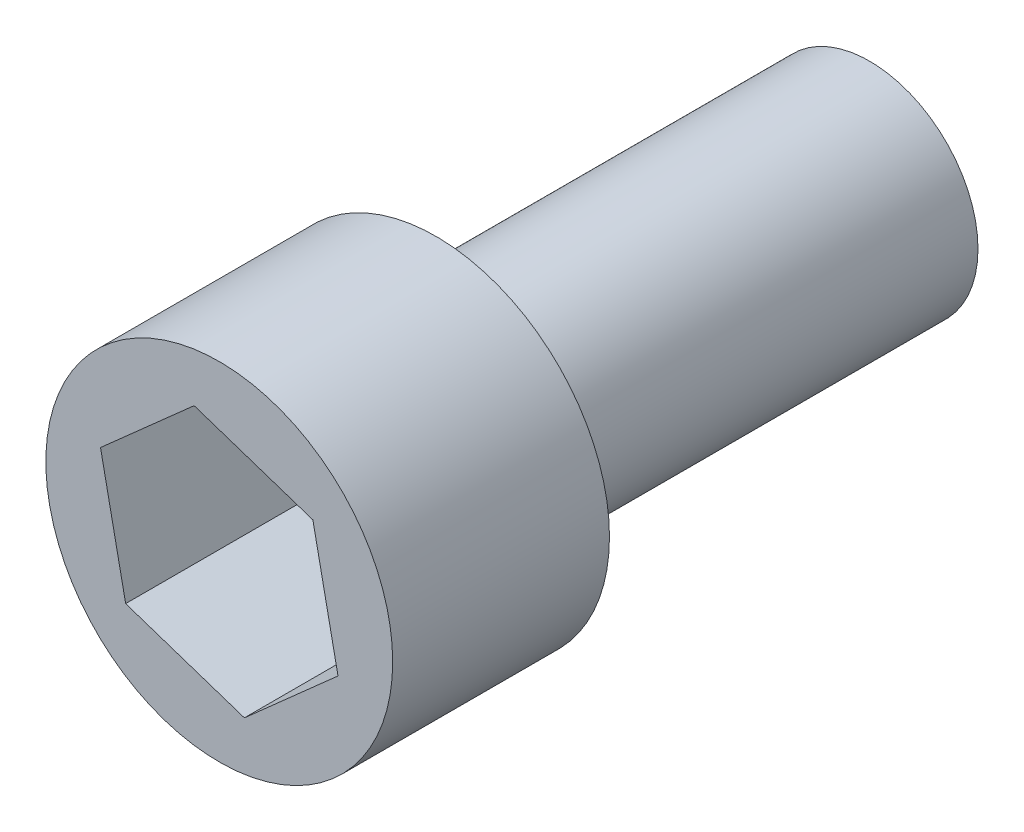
SolidWorks part; units mm, degrees
ref_plane "前视基准面" through (0, 0, 0) normal (0, 0, 1) x (1, 0, 0)
ref_plane "上视基准面" through (0, 0, 0) normal (0, 1, 0) x (1, 0, 0)
ref_plane "右视基准面" through (0, 0, 0) normal (1, 0, 0) x (0, 0, -1)
sketch "草图1" plane through (0, 0, 0) normal (0, 0, 1) x (1, 0, 0)
  circle A0 centre (0, 0) radius 5
extrude "凸台-拉伸1" add sketch "草图1" along normal blind 20
sketch "草图2" plane through (0, 0, 20) normal (0, 0, 1) x (1, 0, 0)
  circle A0 centre (0, 0) radius 8
extrude "凸台-拉伸2" add sketch "草图2" along normal blind 10
sketch "草图3" plane through (0, 0, 30) normal (0, 0, 1) x (1, 0, 0)
  line L1 (-1.1593, 5.6559) -> (-5.4778, 1.824)
  line L2 (-5.4778, 1.824) -> (-4.3185, -3.832)
  line L3 (-4.3185, -3.832) -> (1.1593, -5.6559)
  line L4 (1.1593, -5.6559) -> (5.4778, -1.824)
  line L5 (5.4778, -1.824) -> (4.3185, 3.832)
  line L6 (4.3185, 3.832) -> (-1.1593, 5.6559)
  circle A0 centre (0, 0) radius 5 construction
  dimension "D1" = 10
extrude "切除-拉伸2" cut sketch "草图3" against normal blind 9.5
